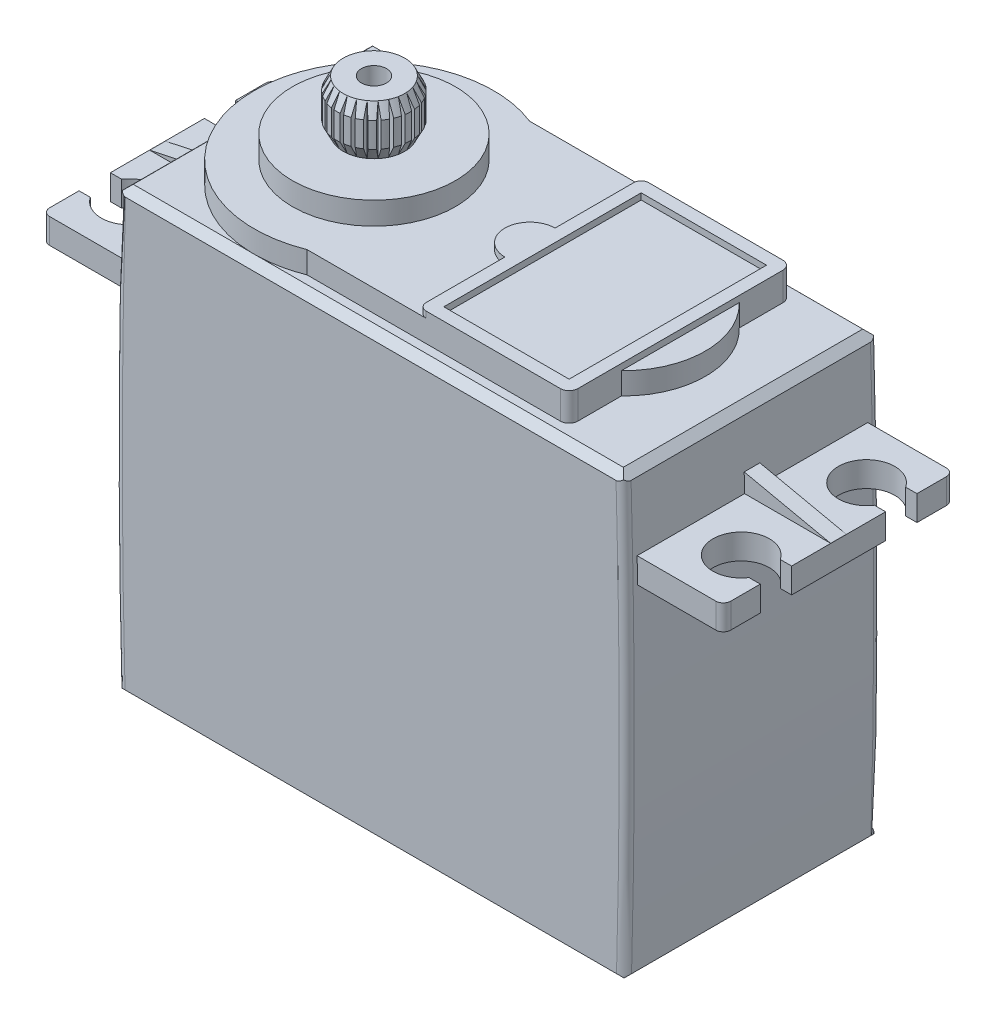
SolidWorks part; units mm, degrees
ref_plane "Front Plane" through (0, 0, 0) normal (0, 0, 1) x (1, 0, 0)
ref_plane "Top Plane" through (0, 0, 0) normal (0, 1, 0) x (1, 0, 0)
ref_plane "Right Plane" through (0, 0, 0) normal (1, 0, 0) x (0, 0, -1)
sketch "Sketch1" plane through (0, 0, 0) normal (0, 0, 1) x (1, 0, 0)
  line L0 (0, 0) -> (-20.425, 0) construction
  line L1 (-20.15, -18.33) -> (20.15, -18.33)
  line L2 (-20.15, -18.33) -> (-20.15, 18.33) construction
  line L3 (-20.15, 18.33) -> (20.15, 18.33)
  line L4 (20.15, -18.33) -> (20.15, 18.33) construction
  line L5 (-20.15, -18.33) -> (20.15, 18.33) construction
  line L6 (-20.15, 18.33) -> (20.15, -18.33) construction
  line L7 (0, 18.33) -> (0, -18.33) construction
  arc A0 (-20.15, -18.33) -> (-20.15, 18.33) centre (590.6014, 0) cw
  arc A1 (20.15, -18.33) -> (20.15, 18.33) centre (-590.6014, 0) ccw
  point P0 (0, 0)
  dimension "D1" = 36.66
  dimension "D2" = 40.3
  dimension "D3" = 20.425
extrude "Boss-Extrude1" add sketch "Sketch1" along normal mid plane 20.3
sketch "Sketch2" plane through (0, 0, 0) normal (0, 0, 1) x (1, 0, 0)
  line L0 (0, -18.33) -> (0, 10.42) construction
  line L1 (-20.15, -18.33) -> (20.15, -18.33) construction
  line L2 (27.175, 10.42) -> (-27.175, 10.42)
  line L3 (27.175, 12.42) -> (-27.175, 12.42)
  line L4 (27.175, 10.42) -> (27.175, 12.42)
  line L5 (-27.175, 10.42) -> (-27.175, 12.42)
  point P8 (0, 10.42)
  dimension "D1" = 54.35
  dimension "D2" = 28.75
  dimension "D3" = 2
  dimension "D4" = 54.35
extrude "Boss-Extrude2" add sketch "Sketch2" along normal mid plane 18.4
sketch "Sketch3" plane through (0, 12.42, 0) normal (0, 1, 0) x (1, 0, 0)
  line L0 (0, 0) -> (-27.175, 0) construction
  line L1 (-27.175, -9.2) -> (-27.175, 9.2) construction
  line L2 (-24.4042, -5) -> (-24.4042, 5) construction
  line L3 (0, 0) -> (0, 10.15) construction
  line L4 (20.15, 10.15) -> (-20.15, 10.15) construction
  line L5 (-26.275, 6.25) -> (-26.275, 3.75) construction
  line L6 (-26.275, 6.25) -> (-27.175, 6.25)
  line L7 (-26.275, 3.75) -> (-27.175, 3.75)
  line L8 (-27.175, 6.25) -> (-27.175, 3.75)
  line L9 (-26.275, -3.75) -> (-27.175, -3.75)
  line L10 (-27.175, -6.25) -> (-27.175, -3.75)
  line L11 (-26.275, -6.25) -> (-27.175, -6.25)
  line L12 (26.275, -6.25) -> (27.175, -6.25)
  line L13 (27.175, -6.25) -> (27.175, -3.75)
  line L14 (26.275, -3.75) -> (27.175, -3.75)
  line L15 (27.175, 6.25) -> (27.175, 3.75)
  line L16 (26.275, 3.75) -> (27.175, 3.75)
  line L17 (26.275, 6.25) -> (27.175, 6.25)
  arc A0 (-26.275, 3.75) -> (-26.275, 6.25) centre (-24.4042, 5) ccw
  arc A4 (-26.275, -3.75) -> (-26.275, -6.25) centre (-24.4042, -5) cw
  arc A5 (26.275, -3.75) -> (26.275, -6.25) centre (24.4042, -5) ccw
  arc A6 (26.275, 3.75) -> (26.275, 6.25) centre (24.4042, 5) cw
  point P8 (-24.4042, 0)
  dimension "D1" = 4.5
  dimension "D2" = 10
  dimension "D3" = 2.5
  dimension "D4" = 0.9
extrude "Cut-Extrude1" cut sketch "Sketch3" against normal up to next
fillet "Fillet2" radius 0.6 4 edges at (27.175, 11.42, 9.2) (27.175, 11.42, -9.2) (-27.175, 11.42, 9.2) (-27.175, 11.42, -9.2)
chamfer "Chamfer1" distance 2 4 edges at (-20.15, -18.33, 0) (0, -18.33, 10.15) (20.15, -18.33, 0) (0, -18.33, -10.15)
sketch "Sketch5" plane through (0, 0, 0) normal (0, 0, 1) x (1, 0, 0)
  line L0 (-20.15, 18.33) -> (-20.15, 13.93) construction
  line L1 (-20.15, 13.93) -> (-20.15, 12.42)
  line L2 (-20.15, 12.42) -> (-27.15, 12.42)
  line L3 (-20.2988, 12.42) -> (-26.575, 12.42) construction
  line L4 (-27.15, 12.42) -> (-20.15, 13.93)
  line L5 (0, 0) -> (0, 18.33) construction
  line L6 (20.15, 18.33) -> (-20.15, 18.33) construction
  line L7 (20.15, 18.33) -> (20.15, 13.93) construction
  line L8 (27.15, 12.42) -> (20.15, 13.93)
  line L9 (20.15, 12.42) -> (27.15, 12.42)
  line L10 (20.15, 13.93) -> (20.15, 12.42)
  line L11 (-20.15, 18.33) -> (0, 18.33) construction
  dimension "D1" = 4.4
  dimension "D2" = 7
  dimension "D3" = 20.15
extrude "Boss-Extrude4" add sketch "Sketch5" along normal mid plane 1.25
chamfer "Chamfer2" distance 0.6 4 edges at (20.15, 18.33, 0) (0, 18.33, 10.15) (-20.15, 18.33, 0) (0, 18.33, -10.15)
sketch "Sketch6" plane through (0, 18.33, 0) normal (0, 1, 0) x (1, 0, 0)
  line L0 (0, 0) -> (-20.2668, 0) construction
  line L1 (14.5488, -8.875) -> (14.5488, 8.875) construction
  line L2 (-20.2668, -0.625) -> (-20.2668, 0.625) construction
  line L3 (-19.4512, 0) -> (16.5488, 0) construction
  line L4 (10.0263, 0) -> (16.5488, 0) construction
  line L5 (20.2988, 9.2) -> (20.2988, 0.625) construction
  line L6 (14.5488, 4.7) -> (14.5488, 8.875)
  line L7 (14.5488, 8.875) -> (-6.3561, 8.875)
  line L8 (14.5488, -4.7) -> (14.5488, -8.875)
  line L9 (14.5488, -8.875) -> (-6.3561, -8.875)
  arc A0 (-6.3561, 8.875) -> (-6.3561, -8.875) centre (-9.8962, 0) ccw
  arc A1 (14.5488, 4.7) -> (14.5488, -4.7) centre (10.0263, 0) cw
  point P15 (14.5488, 0)
  dimension "D1" = 19.11
  dimension "D5" = 9.4
  dimension "D6" = 17.75
  dimension "D2" = 36
  dimension "D3" = 3.75
  dimension "D4" = 5.75
extrude "Boss-Extrude5" add sketch "Sketch6" along normal blind 1.75 contours L7 A0 L9 L8 A1 L6
sketch "Sketch7" plane through (0, 20.08, 0) normal (0, 1, 0) x (1, 0, 0)
  circle A0 centre (-9.8962, 0) radius 6.5
  dimension "D1" = 13
extrude "Boss-Extrude6" add sketch "Sketch7" along normal blind 1.8
sketch "Sketch8" plane through (0, 21.88, 0) normal (0, 1, 0) x (1, 0, 0)
  circle A0 centre (-9.8962, 0) radius 2.95
  dimension "D1" = 5.9
extrude "Boss-Extrude7" add sketch "Sketch8" along normal blind 4
fillet "Fillet3" radius 0.6 4 edges at (20.4246, 0.7003, 10.15) (-20.4246, 0.7003, 10.15) (-20.4246, 0.7003, -10.15) (20.4246, 0.7003, -10.15)
ref_plane "Plane1" through (-20.1879, 0.0231, 0) normal (-1, 0.0011, 0) x (0, 0, 1)
sketch "Sketch9" plane through (-20.1879, 0.0231, 0) normal (-1, 0.0011, 0) x (0, 0, 1)
  line L0 (0, 10.3967) -> (0, -9.6033) construction
  line L1 (-3.5, -13.0533) -> (3.5, -13.0533)
  line L2 (-3.5, -13.0533) -> (-3.5, -9.6033)
  line L3 (-3.5, -9.6033) -> (3.5, -9.6033)
  line L4 (3.5, -13.0533) -> (3.5, -9.6033)
  line L5 (-3.5, -13.0533) -> (3.5, -9.6033) construction
  line L6 (-3.5, -9.6033) -> (3.5, -13.0533) construction
  line L7 (-9.2, 10.3967) -> (9.2, 10.3967) construction
  point P0 (0, -11.3283)
  dimension "D1" = 3.45
  dimension "D2" = 7
  dimension "D3" = 20
extrude "Boss-Extrude8" add sketch "Sketch9" along normal blind 6 draft 1
fillet "Fillet4" radius 0.7 4 edges at (-23.2744, -9.6303, 3.4463) (-23.2444, -12.9736, 3.4469) (-23.2444, -12.9736, -3.4469) (-23.2744, -9.6303, -3.4463)
fillet "Fillet5" radius 0.7 2 edges at (14.5488, 19.205, -8.875) (14.5488, 19.205, 8.875)
sketch "Sketch11" plane through (0, 20.08, 0) normal (0, 1, 0) x (1, 0, 0)
  line L8 (13.8488, 8.875) -> (-6.3561, 8.875) construction
  line L9 (13.8488, -8.875) -> (-6.3561, -8.875) construction
  line L10 (14.5488, 4.7) -> (14.5488, -4.7)
  line L11 (13.5488, 7.875) -> (13.5488, -7.875)
  line L12 (13.5488, 4.2532) -> (13.5488, 7.875)
  line L13 (13.5488, 7.875) -> (-6.5537, 7.875)
  line L14 (-6.5537, -7.875) -> (13.5488, -7.875)
  line L15 (13.5488, -7.875) -> (13.5488, -4.2532)
  line L16 (13.5488, 4.2532) -> (13.5488, 7.875) construction
  line L17 (13.5488, 7.875) -> (-6.5537, 7.875) construction
  line L18 (-6.5537, -7.875) -> (13.5488, -7.875) construction
  line L19 (13.5488, -7.875) -> (13.5488, -4.2532) construction
  line L20 (14.5488, 4.7) -> (14.5488, 8.175)
  line L21 (13.8488, 8.875) -> (-6.3561, 8.875)
  line L22 (-6.3561, -8.875) -> (13.8488, -8.875)
  line L23 (14.5488, -8.175) -> (14.5488, -4.7)
  line L24 (14.5488, 4.7) -> (14.5488, 8.175)
  line L25 (13.8488, 8.875) -> (3.1488, 8.875)
  line L26 (3.1488, -8.875) -> (13.8488, -8.875)
  line L27 (14.5488, -8.175) -> (14.5488, -4.7)
  line L28 (13.5488, -7.875) -> (3.5488, -7.875)
  line L29 (3.5488, -7.875) -> (3.5488, 7.875)
  line L30 (3.5488, 7.875) -> (13.5488, 7.875)
  line L31 (2.5488, 8.275) -> (2.5488, 2)
  line L32 (13.5488, 0) -> (2.5488, 0) construction
  line L33 (2.5488, -2) -> (2.5488, -8.275)
  line L34 (2.5488, 2) -> (2.5488, -2) construction
  arc A8 (2.5488, -8.275) -> (3.1488, -8.875) centre (3.1488, -8.275) ccw
  arc A9 (3.1488, 8.875) -> (2.5488, 8.275) centre (3.1488, 8.275) ccw
  arc A11 (2.5488, 2) -> (2.5488, -2) centre (2.5488, 0) ccw
  arc A12 (-6.5537, 7.875) -> (-6.5537, -7.875) centre (-9.8962, 0) ccw
  arc A13 (13.5488, -4.2532) -> (13.5488, 4.2532) centre (10.0263, 0) ccw
  arc A14 (-6.5537, 7.875) -> (-6.5537, -7.875) centre (-9.8962, 0) ccw construction
  arc A15 (13.5488, -4.2532) -> (13.5488, 4.2532) centre (10.0263, 0) ccw construction
  arc A16 (14.5488, 8.175) -> (13.8488, 8.875) centre (13.8488, 8.175) ccw
  arc A17 (-6.3561, 8.875) -> (-6.3561, -8.875) centre (-9.8962, 0) ccw
  arc A18 (13.8488, -8.875) -> (14.5488, -8.175) centre (13.8488, -8.175) ccw
  arc A19 (14.5488, -4.7) -> (14.5488, 4.7) centre (10.0263, 0) ccw
  arc A20 (14.5488, 8.175) -> (13.8488, 8.875) centre (13.8488, 8.175) ccw
  arc A22 (13.8488, -8.875) -> (14.5488, -8.175) centre (13.8488, -8.175) ccw
  point P29 (2.5488, -8.875)
  point P34 (2.5488, 8.875)
  dimension "D3" = 1
  dimension "D5" = 0.6
  dimension "D6" = 4
  dimension "D4" = 10
  dimension "D1" = 1
  dimension "D2" = 0
extrude "Boss-Extrude9" add sketch "Sketch11" along normal blind 0.5
sketch "Sketch12" plane through (0, 0, 0) normal (0, 0, 1) x (1, 0, 0)
  line L0 (-12.8462, 25.88) -> (-12.8462, 21.88) construction
  line L1 (-12.8462, 25.88) -> (-12.8462, 21.88) construction
  line L2 (-12.8462, 21.88) -> (-12.3462, 21.88)
  line L3 (-3.3962, 21.88) -> (-16.3962, 21.88) construction
  line L4 (-12.3462, 21.88) -> (-12.8462, 22.88)
  line L5 (-12.8462, 22.88) -> (-12.8462, 21.88)
  line L6 (-9.8962, 25.88) -> (-9.8962, 21.88) construction
  line L7 (-6.9462, 25.88) -> (-12.8462, 25.88) construction
  line L8 (-9.8962, 23.88) -> (-12.8462, 23.88) construction
  line L9 (-12.8462, 24.88) -> (-12.8462, 25.88)
  line L10 (-12.3462, 25.88) -> (-12.8462, 24.88)
  line L11 (-12.8462, 25.88) -> (-12.3462, 25.88)
  dimension "D1" = 1
  dimension "D2" = 0.5
revolve "Cut-Revolve1" cut sketch "Sketch12" angle 360 about L6
sketch "Sketch13" plane through (0, 25.88, 0) normal (0, 1, 0) x (1, 0, 0)
  line L0 (-9.8962, -0.0067) -> (-9.8962, 2.95) construction
  line L1 (-9.8962, 2.45) -> (-10.0212, 2.9474)
  line L2 (-9.8962, 2.45) -> (-9.7712, 2.9474)
  circle A0 centre (-9.8962, 0) radius 2.95 construction
  circle A1 centre (-9.8962, 0) radius 2.45 construction
  arc A2 (-10.0212, 2.9474) -> (-9.7712, 2.9474) centre (-9.8962, -0.0067) cw
  circle A3 centre (-9.8962, 0) radius 2.95
  circle A4 centre (-9.8962, 0) radius 2.95 construction
  dimension "D2" = 0.25
  dimension "D3" = 0.5
  dimension "D1" = 0
extrude "Cut-Extrude2" cut sketch "Sketch13" against normal up to next
pattern_circular "CirPattern1" count 25 over 360 about axis through (-9.8962, 0, 0) along (0, 1, 0) of "Cut-Extrude2"
sketch "Sketch15" plane through (0, 25.88, 0) normal (0, 1, 0) x (1, 0, 0)
  line L0 (-9.8962, -2.95) -> (-9.8962, 0) construction
  arc A0 (-10.1416, -2.9398) -> (-9.6509, -2.9398) centre (-9.8962, 0) ccw construction
  circle A1 centre (-9.8962, 0) radius 1
  dimension "D1" = 2
extrude "Cut-Extrude4" cut sketch "Sketch15" against normal up to surface (4 mm away)
sketch "Sketch17" plane through (0, 0, 0) normal (0, 1, 0) x (1, 0, 0)
  line L0 (-27.15, 0) -> (27.15, 0) construction
  line L1 (-27.15, -0.625) -> (-27.15, 0.625) construction
  line L2 (27.15, -0.625) -> (27.15, 0.625) construction
  line L3 (0, -10.15) -> (0, 10.15)
  line L4 (-19.5675, 10.15) -> (19.5675, 10.15) construction
  line L5 (0, 0) -> (-20.2668, 0) construction
  line L6 (-20.2668, -0.625) -> (-20.2668, 0.625) construction
  line L7 (-24.4042, 5) -> (-24.4042, 0) construction
  circle A0 centre (-24.4042, 5) radius 2.25
  circle A1 centre (-9.8962, 0) radius 1 construction
  circle A2 centre (-9.8962, 0) radius 1
  point P15 (0, 0)
  dimension "D3" = 9.8962
  dimension "D5" = 5
  dimension "D1" = 20.3
  dimension "D2" = 54.3
  dimension "D4" = 20.2668
  dimension "D6" = 24.4042
